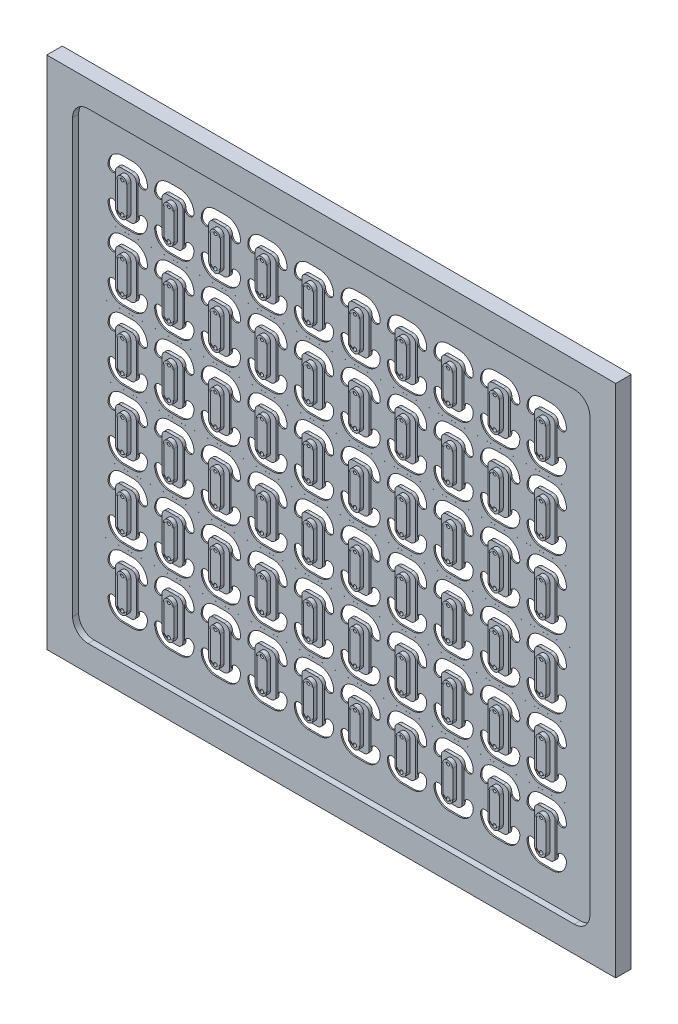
SolidWorks part; units mm, degrees
ref_plane "Front Plane" through (0, 0, 0) normal (0, 0, 1) x (1, 0, 0)
ref_plane "Top Plane" through (0, 0, 0) normal (0, 1, 0) x (1, 0, 0)
ref_plane "Right Plane" through (0, 0, 0) normal (1, 0, 0) x (0, 0, -1)
sketch "Sketch1" plane through (0, 0, 0) normal (0, 0, 1) x (1, 0, 0)
  line L0 (1.8264, -1.8191) -> (1.8264, 3.4785)
  line L1 (-0.0892, -1.8191) -> (-0.0892, 3.4785)
  line L2 (0.8686, -2.298) -> (0.8686, -1.3402) construction
  line L3 (0.8686, 2.9996) -> (0.8686, 3.9574) construction
  arc A0 (1.8264, 2.9996) -> (-0.0892, 2.9996) centre (0.8686, 2.9996) ccw construction
  arc A1 (-0.0892, -1.3402) -> (1.8264, -1.3402) centre (0.8686, -1.3402) ccw construction
  arc A4 (-0.0892, -1.8191) -> (1.8264, -1.8191) centre (0.8686, -1.8191) ccw
  arc A5 (1.8264, 3.4785) -> (-0.0892, 3.4785) centre (0.8686, 3.4785) ccw
extrude "Extrude1" add sketch "Sketch1" along normal blind 0.8
sketch "Sketch3" plane through (0, 0, 0.8) normal (0, 0, 1) x (1, 0, 0)
  line L0 (1.8264, 2.9996) -> (1.8264, -1.3402)
  line L1 (0.8686, 2.9996) -> (0.8686, 3.9574) construction
  line L2 (-0.0892, -1.3402) -> (-0.0892, 2.9996)
  line L3 (1.8264, 2.9996) -> (1.8264, 3.4785)
  line L4 (1.8264, -1.8191) -> (1.8264, 3.4785) construction
  line L5 (-0.0892, 2.9996) -> (-0.0892, 3.4785)
  line L6 (-0.0892, -1.8191) -> (-0.0892, 3.4785) construction
  line L7 (1.6981, 3.4785) -> (1.8264, 3.4785) construction
  line L8 (0.8686, -1.3402) -> (0.8686, -2.298) construction
  line L11 (1.8264, -1.3402) -> (1.8264, -1.8191)
  line L12 (-0.0892, -1.3402) -> (-0.0892, -1.8191)
  arc A0 (1.6981, 3.4785) -> (0.0392, 3.4785) centre (0.8686, 2.9996) ccw
  arc A1 (0.0392, -1.8191) -> (1.6981, -1.8191) centre (0.8686, -1.3402) ccw
  arc A2 (1.6981, 3.4785) -> (1.8264, 3.4785) centre (1.7623, 3.5155) ccw
  arc A3 (0.0392, 3.4785) -> (-0.0892, 3.4785) centre (-0.025, 3.5155) cw
  arc A4 (1.6981, -1.8191) -> (1.8264, -1.8191) centre (1.7623, -1.8561) cw
  arc A5 (0.0392, -1.8191) -> (-0.0892, -1.8191) centre (-0.025, -1.8561) ccw
extrude "Cut-Extrude1" cut sketch "Sketch3" against normal blind 0.1
sketch "Sketch4" plane through (0, 0, 0) normal (0, 0, -1) x (-1, 0, 0)
  line L1 (-1.8686, 4.9574) -> (0.1314, 4.9574)
  line L2 (-2.8686, 3.9574) -> (-2.8686, -2.298)
  line L3 (-1.8686, -3.298) -> (0.1314, -3.298)
  line L4 (1.1314, 3.9574) -> (1.1314, -2.298)
  arc A10 (-1.8686, -3.298) -> (-2.8686, -2.298) centre (-1.8686, -2.298) cw
  arc A11 (1.1314, -2.298) -> (0.1314, -3.298) centre (0.1314, -2.298) cw
  arc A12 (0.1314, 4.9574) -> (1.1314, 3.9574) centre (0.1314, 3.9574) cw
  arc A13 (-2.8686, 3.9574) -> (-1.8686, 4.9574) centre (-1.8686, 3.9574) cw
  dimension "D1" = 1
  dimension "D5" = 1
  dimension "D6" = 1
  dimension "D2" = 1
  dimension "D3" = 2
  dimension "D4" = 2
extrude "Extrude2" add sketch "Sketch4" along normal blind 0.61
sketch "Sketch5" plane through (0, 0, 0.7) normal (0, 0, 1) x (1, 0, 0)
  circle A0 centre (0.8686, 3.7574) radius 0.32
  circle A1 centre (0.8686, -2.098) radius 0.32
  arc A4 (1.6981, 3.4785) -> (0.0392, 3.4785) centre (0.8686, 2.9996) ccw construction
  dimension "D1" = 0.2
  dimension "D2" = 0.2
extrude "Cut-Extrude3" cut sketch "Sketch5" against normal up to surface and the other way up to surface
sketch "Sketch14" plane through (0, 0, -0.61) normal (0, 0, -1) x (-1, 0, 0)
  line L0 (0.1314, 4.9574) -> (-1.8686, 4.9574) construction
  line L1 (-2.8686, 3.9574) -> (-2.8686, -2.298) construction
  circle A0 centre (-0.8686, 0.8299) radius 1
  dimension "D1" = 4.1275
  dimension "D2" = 2
extrude "Extrude6" add sketch "Sketch14" along normal blind 1.59
sketch "Sketch6" plane through (0, 0, -0.61) normal (0, 0, -1) x (-1, 0, 0)
  line L0 (1.1314, -2.298) -> (1.1314, 3.9574) construction
  line L1 (-5.3686, 7.4574) -> (3.6314, 7.4574)
  line L2 (-5.3686, 7.4574) -> (-5.3686, -5.798)
  line L3 (-5.3686, -5.798) -> (3.6314, -5.798)
  line L4 (3.6314, 7.4574) -> (3.6314, -5.798)
  line L5 (-2.8686, 3.9574) -> (-2.8686, -2.298) construction
  line L6 (0.1314, 4.9574) -> (-1.8686, 4.9574) construction
  line L7 (-1.8686, -3.298) -> (0.1314, -3.298) construction
  dimension "D1" = 2.5
  dimension "D2" = 2.5
  dimension "D3" = 2.5
  dimension "D4" = 2.5
extrude "Extrude3" add sketch "Sketch6" against normal blind 0.25
sketch "Sketch7" plane through (0, 0, -0.61) normal (0, 0, -1) x (-1, 0, 0)
  line L0 (-1.8686, -3.298) -> (0.1314, -3.298) construction
  line L1 (2.9314, 3.9574) -> (2.9314, -2.298) construction
  line L2 (-1.8686, 4.9574) -> (0.1314, 4.9574) construction
  line L3 (-4.6686, 3.9574) -> (-4.6686, -2.298) construction
  line L4 (-1.8686, -3.298) -> (0.1314, -3.298)
  line L6 (-1.8686, 4.9574) -> (0.1314, 4.9574)
  line L7 (-1.8686, -5.098) -> (0.1314, -5.098)
  line L8 (1.1314, 3.9574) -> (1.1314, -2.298) construction
  line L9 (-1.8686, 6.7574) -> (0.1314, 6.7574)
  line L10 (-2.8686, 3.9574) -> (-4.6686, 3.9574) construction
  line L11 (-2.8686, -2.298) -> (-4.6686, -2.298) construction
  line L12 (1.1314, -2.298) -> (2.9314, -2.298) construction
  line L13 (1.1314, 3.9574) -> (2.9314, 3.9574) construction
  line L14 (-2.8686, 3.9574) -> (-2.8686, -2.298) construction
  arc A0 (-2.8686, -2.298) -> (-1.8686, -3.298) centre (-1.8686, -2.298) ccw construction
  arc A1 (0.1314, -3.298) -> (1.1314, -2.298) centre (0.1314, -2.298) ccw construction
  arc A2 (1.1314, 3.9574) -> (0.1314, 4.9574) centre (0.1314, 3.9574) ccw construction
  arc A3 (-1.8686, 4.9574) -> (-2.8686, 3.9574) centre (-1.8686, 3.9574) ccw construction
  arc A4 (-2.8686, -2.298) -> (-1.8686, -3.298) centre (-1.8686, -2.298) ccw
  arc A5 (0.1314, -3.298) -> (1.1314, -2.298) centre (0.1314, -2.298) ccw
  arc A6 (1.1314, 3.9574) -> (0.1314, 4.9574) centre (0.1314, 3.9574) ccw
  arc A7 (-1.8686, 4.9574) -> (-2.8686, 3.9574) centre (-1.8686, 3.9574) ccw
  arc A8 (0.1314, -5.098) -> (2.9314, -2.298) centre (0.1314, -2.298) ccw
  arc A9 (-4.6686, -2.298) -> (-1.8686, -5.098) centre (-1.8686, -2.298) ccw
  arc A10 (-1.8686, 6.7574) -> (-4.6686, 3.9574) centre (-1.8686, 3.9574) ccw
  arc A11 (2.9314, 3.9574) -> (0.1314, 6.7574) centre (0.1314, 3.9574) ccw
  arc A12 (1.1314, 3.9574) -> (2.9314, 3.9574) centre (2.0314, 3.9574) ccw
  arc A13 (-4.6686, 3.9574) -> (-2.8686, 3.9574) centre (-3.7686, 3.9574) ccw
  arc A14 (-2.8686, -2.298) -> (-4.6686, -2.298) centre (-3.7686, -2.298) ccw
  arc A15 (2.9314, -2.298) -> (1.1314, -2.298) centre (2.0314, -2.298) ccw
  dimension "D1" = 1.8
extrude "Cut-Extrude4" cut sketch "Sketch7" against normal up to surface (0.25 mm away)
pattern_linear "LPattern1" count 10 spacing 9 along (1, 0, 0) count 6 spacing 13.26 along (0, -1, 0)
sketch "Sketch9" plane through (0, 0, -0.61) normal (0, 0, -1) x (-1, 0, 0)
  line L0 (-91.3686, 12.4574) -> (-91.3686, -77.098)
  line L1 (-86.3686, 7.4574) -> (3.6314, 7.4574)
  line L2 (-86.3686, 7.4574) -> (-86.3686, -72.098)
  line L3 (-86.3686, -72.098) -> (3.6314, -72.098)
  line L4 (3.6314, 7.4574) -> (3.6314, -72.098)
  line L5 (-91.3686, -77.098) -> (8.6314, -77.098)
  line L6 (8.6314, 12.4574) -> (8.6314, -77.098)
  line L7 (-91.3686, 12.4574) -> (8.6314, 12.4574)
  dimension "D1" = 5
sketch "Sketch10" plane through (0, 0, -0.61) normal (0, 0, -1) x (-1, 0, 0)
  line L0 (-91.3686, 12.4574) -> (-91.3686, -77.098)
  line L1 (-86.3686, 7.4574) -> (3.6314, 7.4574)
  line L2 (-86.3686, 7.4574) -> (-86.3686, -72.098)
  line L3 (-86.3686, -72.098) -> (3.6314, -72.098)
  line L4 (3.6314, 7.4574) -> (3.6314, -72.098)
  line L5 (-91.3686, -77.098) -> (8.6314, -77.098)
  line L6 (8.6314, 12.4574) -> (8.6314, -77.098)
  line L7 (-91.3686, 12.4574) -> (8.6314, 12.4574)
extrude "Extrude4" add sketch "Sketch10" against normal up to surface (0.25 mm away)
sketch "Sketch11" plane through (0, 0, -0.61) normal (0, 0, -1) x (-1, 0, 0)
  line L0 (-96.3686, -82.098) -> (-96.3686, 17.4574)
  line L1 (-91.3686, -77.098) -> (8.6314, -77.098)
  line L2 (-91.3686, -77.098) -> (-91.3686, 12.4574)
  line L3 (-91.3686, 12.4574) -> (8.6314, 12.4574)
  line L4 (8.6314, -77.098) -> (8.6314, 12.4574)
  line L5 (-96.3686, 17.4574) -> (13.6314, 17.4574)
  line L6 (13.6314, -82.098) -> (13.6314, 17.4574)
  line L7 (-96.3686, -82.098) -> (13.6314, -82.098)
  dimension "D1" = 5
sketch "Sketch12" plane through (0, 0, -0.61) normal (0, 0, -1) x (-1, 0, 0)
  line L0 (-96.3686, -82.098) -> (-96.3686, 17.4574)
  line L1 (-88.3686, -77.098) -> (5.6314, -77.098)
  line L2 (-91.3686, -74.098) -> (-91.3686, 9.4574)
  line L3 (-88.3686, 12.4574) -> (5.6314, 12.4574)
  line L4 (8.6314, -74.098) -> (8.6314, 9.4574)
  line L5 (-96.3686, 17.4574) -> (13.6314, 17.4574)
  line L6 (13.6314, -82.098) -> (13.6314, 17.4574)
  line L7 (-96.3686, -82.098) -> (13.6314, -82.098)
  arc A0 (-91.3686, 9.4574) -> (-88.3686, 12.4574) centre (-88.3686, 9.4574) cw
  arc A1 (-88.3686, -77.098) -> (-91.3686, -74.098) centre (-88.3686, -74.098) cw
  arc A2 (5.6314, 12.4574) -> (8.6314, 9.4574) centre (5.6314, 9.4574) cw
  arc A3 (5.6314, -77.098) -> (8.6314, -74.098) centre (5.6314, -74.098) ccw
  dimension "D1" = 3
extrude "Extrude5" add sketch "Sketch12" against normal blind 1.41
sketch "Sketch15" plane through (0, 0, -0.61) normal (0, 0, -1) x (-1, 0, 0)
  line L1 (13.6314, -82.098) -> (-96.3686, -82.098)
  line L2 (13.6314, -82.098) -> (13.6314, 17.4574)
  line L3 (13.6314, 17.4574) -> (-96.3686, 17.4574)
  line L4 (-96.3686, -82.098) -> (-96.3686, 17.4574)
  line L5 (8.6314, -77.098) -> (-91.3686, -77.098)
  line L6 (8.6314, -77.098) -> (8.6314, 12.4574)
  line L7 (8.6314, 12.4574) -> (-91.3686, 12.4574)
  line L8 (-91.3686, -77.098) -> (-91.3686, 12.4574)
extrude "Extrude7" add sketch "Sketch15" along normal blind 1.59
fillet "Fillet1" radius 3 1 edges at (-8.6314, -77.098, -1.405)
fillet "Fillet2" radius 3 1 edges at (91.3686, -77.098, -1.405)
fillet "Fillet3" radius 3 1 edges at (91.3686, 12.4574, -1.405)
fillet "Fillet4" radius 3 1 edges at (-8.6314, 12.4574, -1.405)
